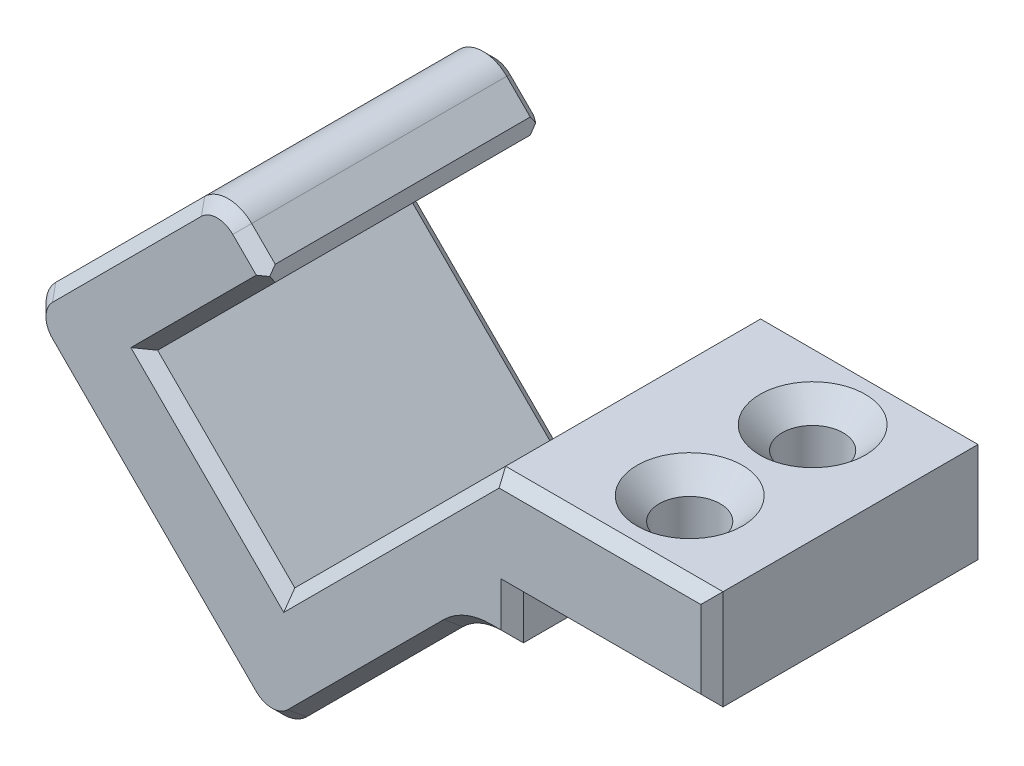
SolidWorks part; units mm, degrees
ref_plane "Plan de face" through (0, 0, 0) normal (0, 0, 1) x (1, 0, 0)
ref_plane "Plan de dessus" through (0, 0, 0) normal (0, 1, 0) x (1, 0, 0)
ref_plane "Plan de droite" through (0, 0, 0) normal (1, 0, 0) x (0, 0, -1)
sketch "Esquisse1" plane through (0, 0, 0) normal (0, 0, 1) x (1, 0, 0)
  line L0 (0, 0) -> (0, -78.8818) construction
  line L1 (0, 0) -> (-59.1081, -59.1081) construction
  line L2 (0, 0) -> (19.0104, 19.0104)
  line L3 (0, 0) -> (-12.3744, 12.3744)
  line L4 (-12.3744, 12.3744) -> (-1.0607, 23.6881)
  line L5 (-1.0607, 23.6881) -> (-6.0104, 28.6378)
  line L6 (-6.0104, 28.6378) -> (-23.6881, 10.9602)
  line L7 (-23.6881, 10.9602) -> (-1.0607, -11.6673)
  line L8 (-1.0607, -11.6673) -> (16.617, 6.0104)
  line L9 (16.617, 6.0104) -> (20.617, 6.0104)
  line L10 (20.617, 6.0104) -> (20.617, 10.0104)
  line L11 (20.617, 10.0104) -> (38.617, 10.0104)
  line L12 (38.617, 10.0104) -> (38.617, 19.0104)
  line L13 (19.0104, 19.0104) -> (38.617, 19.0104)
  line L15 (0, 0) -> (0, 1.118)
  dimension "D2" = 17.5
  dimension "D3" = 7
  dimension "D4" = 16
  dimension "D5" = 25
  dimension "D6" = 32
  dimension "D7" = 4
  dimension "D8" = 4
  dimension "D9" = 18
  dimension "D10" = 9
  dimension "D11" = 25
  dimension "D12" = 0
  dimension "D13" = 45
  dimension "D14" = 90
extrude "Boss.-Extru.1" add sketch "Esquisse1" along normal blind 25 contours L13 L2 L3 L4 L5 L6 L7 L8 L9 L10 L11 L12
fillet "Congé1" radius 3 3 edges at (-6.0104, 28.6378, 12.5) (-23.6881, 10.9602, 12.5) (-1.0607, -11.6673, 12.5)
fillet "Congé2" radius 5 1 edges at (16.617, 6.0104, 12.5)
chamfer "Chanfrein1" distance 1 angle 45 16 edges at (-6.7175, 18.0312, 25) (-6.1872, 6.1872, 25) (9.5052, 9.5052, 25) (28.8137, 19.0104, 25) (38.617, 14.5104, 25) (29.617, 10.0104, 25) (20.617, 8.0104, 25) (19.6525, 6.0104, 25) (16.7747, 5.6298, 25) (8.1066, -2.5, 25) (-1.0607, -10.4246, 25) (-12.3744, -0.3536, 25) (-22.4454, 10.9602, 25) (-14.8492, 19.799, 25) (-6.0104, 27.3952, 25) (-2.4749, 25.1023, 25)
chamfer "Chanfrein2" distance 1 angle 45 16 edges at (-22.4454, 10.9602, 0) (-12.3744, -0.3536, 0) (-1.0607, -10.4246, 0) (8.1066, -2.5, 0) (16.7747, 5.6298, 0) (19.6525, 6.0104, 0) (20.617, 8.0104, 0) (29.617, 10.0104, 0) (38.617, 14.5104, 0) (28.8137, 19.0104, 0) (9.5052, 9.5052, 0) (-6.1872, 6.1872, 0) (-6.7175, 18.0312, 0) (-2.4749, 25.1023, 0) (-6.0104, 27.3952, 0) (-14.8492, 19.799, 0)
chamfer "Chanfrein3" distance 1 angle 45 1 edges at (-1.0607, 23.6881, 12.5)
sketch "Esquisse2" plane through (5.3033, -5.3033, 0) normal (0.7071, -0.7071, 0) x (0, 0, -1)
  line L0 (-25, -6) -> (-25, 13.9289) construction
  line L1 (-1, -9) -> (-24, -9) construction
  circle A0 centre (-12.5, 7.5) radius 1.75
  dimension "D1" = 3.5
  dimension "D2" = 12.5
  dimension "D3" = 16.5
extrude "Enlèv. mat.-Extru.2" cut sketch "Esquisse2" against normal blind 25
chamfer "Chanfrein4" distance 2 angle 45 1 edges at (11.844, 1.2374, 12.5)
sketch "Esquisse3" plane through (0, 19.0104, 0) normal (0, 1, 0) x (1, 0, 0)
  line L0 (37.617, -25) -> (19.4246, -25) construction
  line L1 (19.4246, 0) -> (37.617, 0) construction
  line L2 (38.617, -24) -> (38.617, -1) construction
  circle A0 centre (29.617, -6.9136) radius 2.75
  circle A1 centre (29.617, -18) radius 2.75
  point P6 (28.5208, 0)
  dimension "D1" = 5.5
  dimension "D2" = 5.5
  dimension "D3" = 7
  dimension "D4" = 7
  dimension "D5" = 9
  dimension "D6" = 9
extrude "Enlèv. mat.-Extru.3" cut sketch "Esquisse3" against normal blind 10
chamfer "Chanfrein5" distance 2 angle 45 2 edges at (29.617, 19.0104, 9.6636) (29.617, 19.0104, 20.75)
